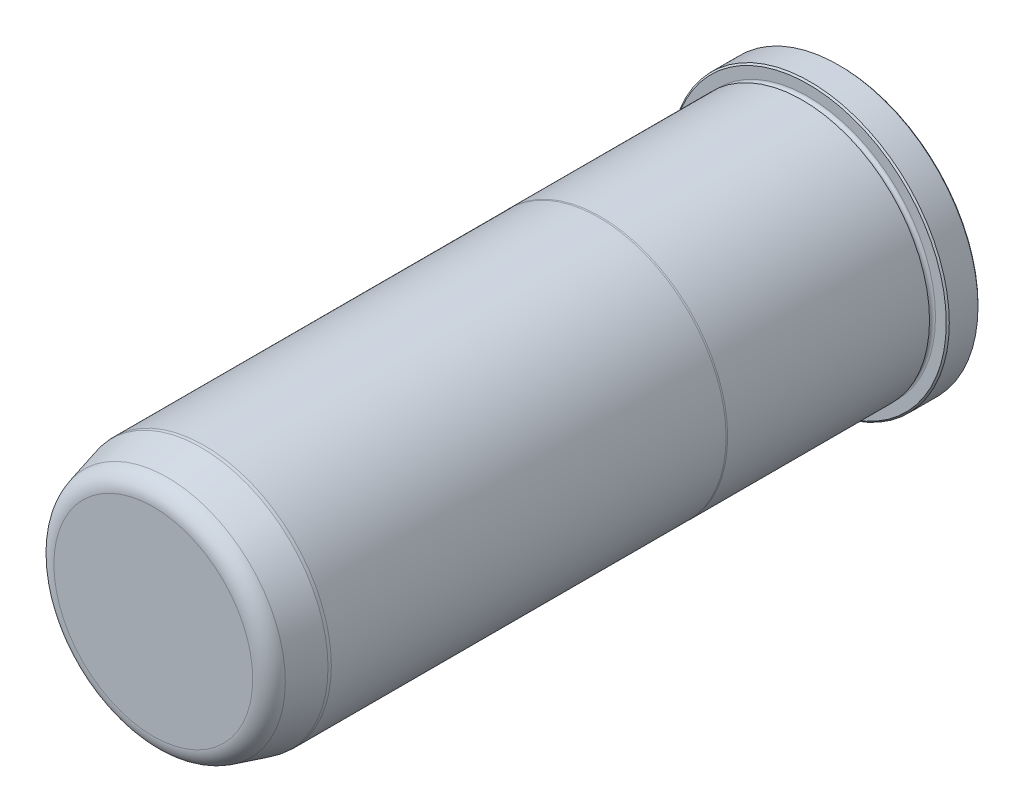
SolidWorks part; units mm, degrees
ref_plane "Front Plane" through (0, 0, 0) normal (0, 0, 1) x (1, 0, 0)
ref_plane "Top Plane" through (0, 0, 0) normal (0, 1, 0) x (1, 0, 0)
ref_plane "Right Plane" through (0, 0, 0) normal (1, 0, 0) x (0, 0, -1)
sketch "Sketch1" plane through (0, 0, 0) normal (1, 0, 0) x (0, 0, -1)
  line L0 (0, 0) -> (0, 34.798)
  line L1 (0, 34.798) -> (-7.9248, 34.798)
  line L2 (-7.9248, 34.798) -> (-7.9248, 31.7373)
  line L3 (-7.9248, 30.9753) -> (-9.4488, 30.9753) construction
  line L4 (-9.4488, 31.7373) -> (-9.4488, 31.7627)
  line L5 (-9.4488, 31.7627) -> (-59.8348, 31.7627)
  line L6 (-59.8348, 31.7627) -> (-60.198, 31.7373)
  line L7 (-60.198, 31.7373) -> (-158.75, 31.7373)
  line L9 (-171.45, 28.4719) -> (-171.45, 0)
  line L10 (-171.45, 0) -> (0, 0)
  line L11 (0, 0) -> (13.6287, 0) construction
  line L12 (-158.75, 31.7373) -> (-159.512, 31.6706)
  line L13 (-159.512, 31.6706) -> (-171.45, 28.4719)
  arc A0 (-9.4488, 31.7373) -> (-7.9248, 31.7373) centre (-8.6868, 31.7373) ccw
  dimension "D14" = 1.524
  dimension "D1" = 7.9248
  dimension "D2" = 1.524
  dimension "D3" = 69.596
  dimension "D4" = 63.5254
  dimension "D5" = 60.198
  dimension "D6" = 171.45
  dimension "D7" = 0.7874
  dimension "D8" = 4
  dimension "D9" = 63.4746
  dimension "D10" = 5
  dimension "D11" = 15
  dimension "D12" = 0.762
  dimension "D13" = 12.7
revolve "Revolve1" add sketch "Sketch1" angle 360 about L11
fillet "Fillet6" radius 4.7625 1 edges at (28.4719, 0, 171.45)
chamfer "Chamfer1" distance 0.381 angle 45 2 edges at (34.798, 0, 0) (34.798, 0, 7.9248)
